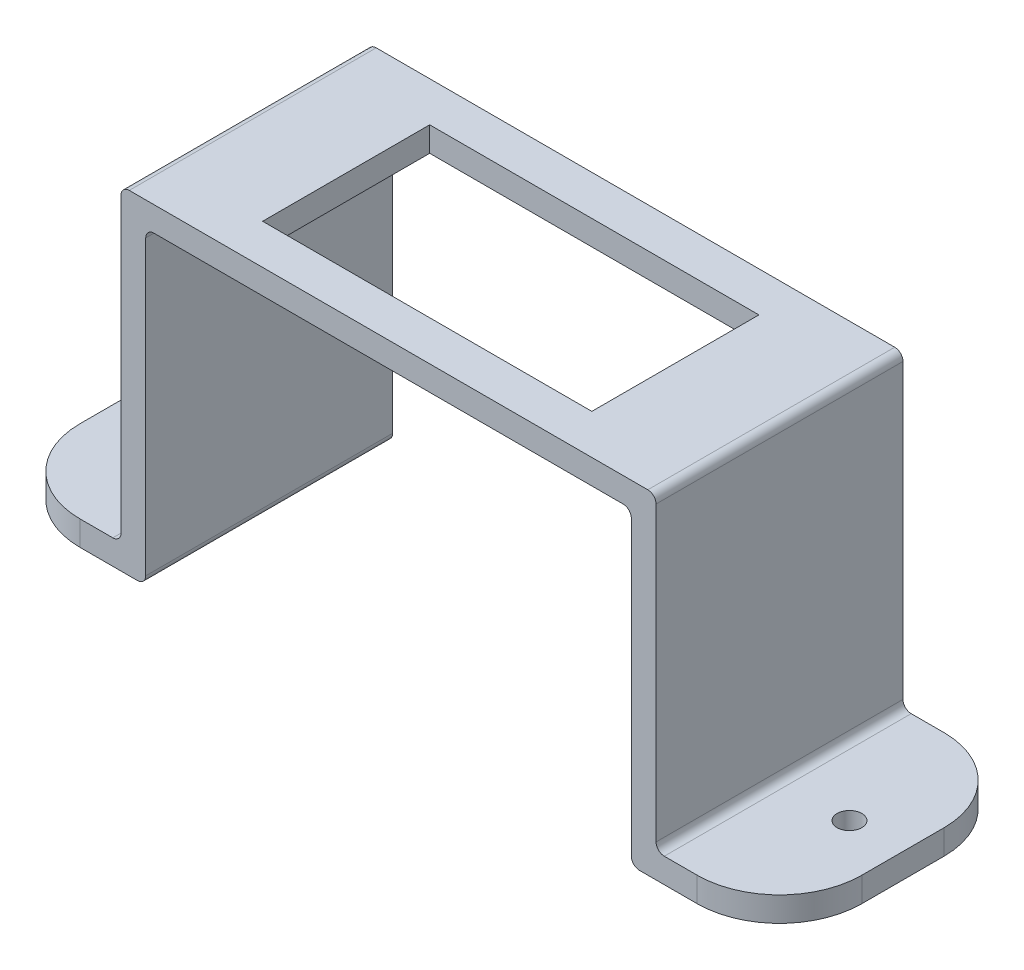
SolidWorks part; units mm, degrees
ref_plane "Plan de face" through (0, 0, 0) normal (0, 0, 1) x (1, 0, 0)
ref_plane "Plan de dessus" through (0, 0, 0) normal (0, 1, 0) x (1, 0, 0)
ref_plane "Plan de droite" through (0, 0, 0) normal (1, 0, 0) x (0, 0, -1)
sketch "Esquisse1" plane through (0, 0, 0) normal (0, 0, 1) x (1, 0, 0)
  line L0 (0, 0) -> (15, 0)
  line L1 (15, 0) -> (15, 37.5557)
  line L2 (15, 37.5557) -> (80, 37.5557)
  line L3 (80, 37.5557) -> (80, 0)
  line L4 (80, 0) -> (95, 0)
extrude "Extru.-Mince1" add sketch "Esquisse1" along normal blind 30 thin
sketch "Esquisse2" plane through (0, 0, 0) normal (0, 1, 0) x (1, 0, 0)
  circle A0 centre (88.5, -15) radius 1.5
  circle A1 centre (7.5, -15) radius 1.5
extrude "Extrusion1" cut sketch "Esquisse2" against normal blind 3
sketch "Esquisse3" plane through (0, 37.5557, 0) normal (0, 1, 0) x (1, 0, 0)
  line L1 (27.35, -25.15) -> (67.35, -25.15)
  line L2 (27.35, -25.15) -> (27.35, -4.85)
  line L3 (27.35, -4.85) -> (67.35, -4.85)
  line L4 (67.35, -25.15) -> (67.35, -4.85)
extrude "Extrusion2" cut sketch "Esquisse3" against normal blind 30
fillet "Congé5" radius 1 2 edges at (15, 37.5557, 15) (80, 37.5557, 15)
fillet "Congé6" radius 1 2 edges at (77, -3, 15) (77, 34.5557, 15)
fillet "Congé7" radius 1 2 edges at (18, -3, 15) (18, 34.5557, 15)
fillet "Congé8" radius 1 1 edges at (80, 0, 15)
fillet "Congé9" radius 1 1 edges at (15, 0, 15)
fillet "Congé10" radius 10 2 edges at (0, -1.5, 30) (95, -1.5, 30)
fillet "Congé11" radius 10 2 edges at (0, -1.5, 0) (95, -1.5, 0)
